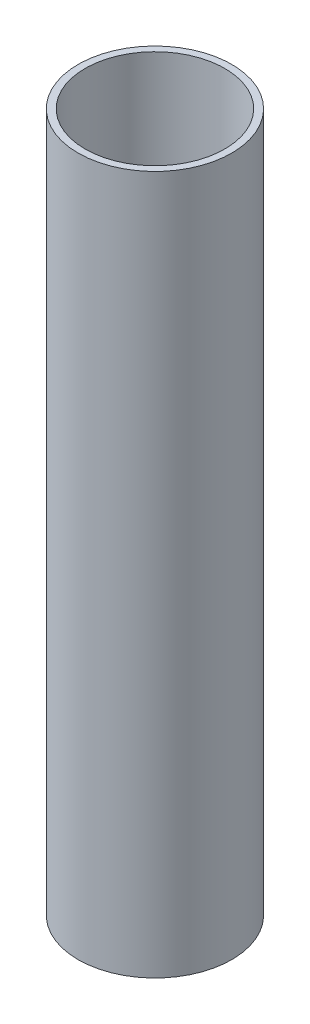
SolidWorks part; units mm, degrees
ref_plane "Plan de face" through (0, 0, 0) normal (0, 0, 1) x (1, 0, 0)
ref_plane "Plan de dessus" through (0, 0, 0) normal (0, 1, 0) x (1, 0, 0)
ref_plane "Plan de droite" through (0, 0, 0) normal (1, 0, 0) x (0, 0, -1)
sketch "Esquisse1" plane through (0, 0, 0) normal (0, 1, 0) x (1, 0, 0)
  circle A1 centre (0, 0) radius 110
extrude "Forme extérieure" add sketch "Esquisse1" along normal blind 1000
shell "Trou" thickness 10
